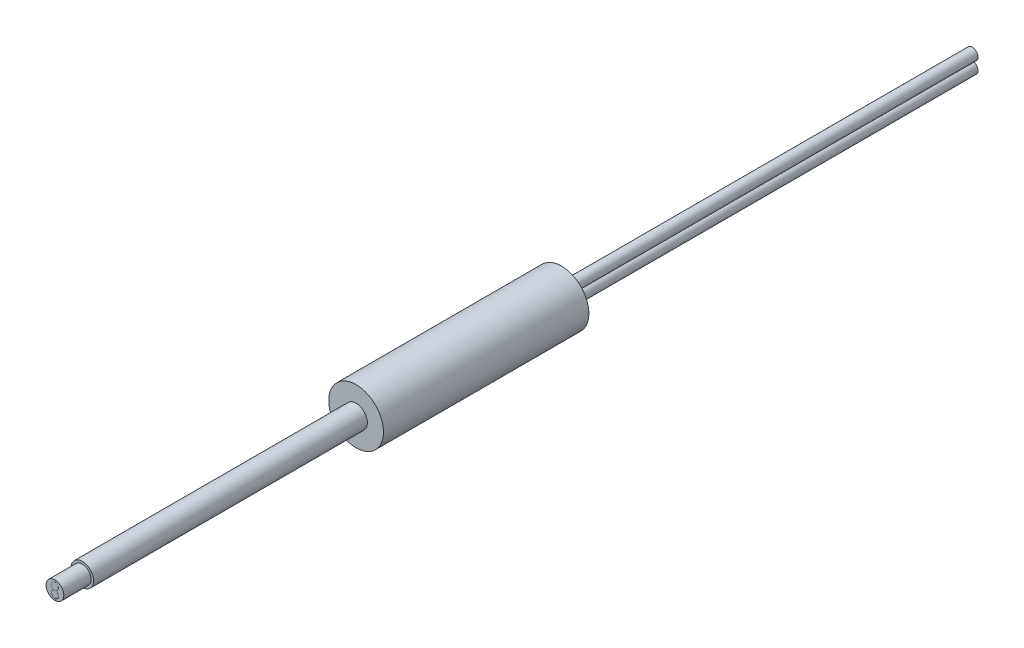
SolidWorks part; units mm, degrees
ref_plane "前视基准面" through (0, 0, 0) normal (0, 0, 1) x (1, 0, 0)
ref_plane "上视基准面" through (0, 0, 0) normal (0, 1, 0) x (1, 0, 0)
ref_plane "右视基准面" through (0, 0, 0) normal (1, 0, 0) x (0, 0, -1)
sketch "草图2" plane through (0, 0, 0) normal (0, 0, 1) x (1, 0, 0)
  circle A0 centre (0, 0) radius 2
  dimension "D1" = 4
extrude "凸台-拉伸1" add sketch "草图2" against normal blind 15
sketch "草图3" plane through (0, 0, 0) normal (0, 0, 1) x (1, 0, 0)
  circle A0 centre (0, 0) radius 0.825
  dimension "D1" = 1.65
extrude "凸台-拉伸2" add sketch "草图3" along normal blind 20
sketch "草图4" plane through (0, 0, 20) normal (0, 0, 1) x (1, 0, 0)
  circle A0 centre (0, 0) radius 0.65
  dimension "D1" = 1.3
extrude "凸台-拉伸3" add sketch "草图4" along normal blind 2
sketch "草图5" plane through (0, 0, -15) normal (0, 0, -1) x (-1, 0, 0)
  circle A0 centre (0, 0.4288) radius 0.4188
  circle A1 centre (0, -0.4288) radius 0.4188
  dimension "D1" = 0.01
  dimension "D2" = 0.8376
  dimension "D3" = 0.01
extrude "凸台-拉伸4" add sketch "草图5" along normal blind 30
sketch "草图6" plane through (0, 0, 22) normal (0, 0, 1) x (1, 0, 0)
  circle A3 centre (0, 0.265) radius 0.255
  circle A4 centre (0, -0.265) radius 0.255
  circle A5 centre (0, 0.265) radius 0.25
  circle A6 centre (0, -0.265) radius 0.25
  dimension "D1" = 0.51
  dimension "D2" = 0.01
  dimension "D4" = 0.5
  dimension "D3" = 0.01
extrude "切除-拉伸1" cut sketch "草图6" against normal blind 0.1
